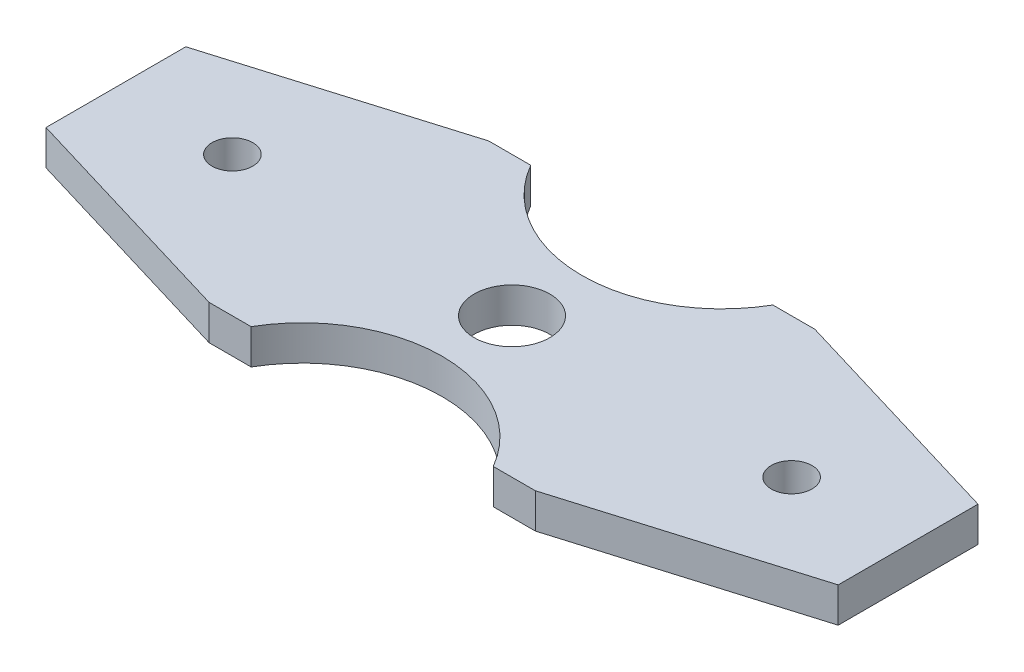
SolidWorks part; units mm, degrees
ref_plane "Front" through (0, 0, 0) normal (0, 0, 1) x (1, 0, 0)
ref_plane "Top" through (0, 0, 0) normal (0, 1, 0) x (1, 0, 0)
ref_plane "Right" through (0, 0, 0) normal (1, 0, 0) x (0, 0, -1)
sketch "Sketch1" plane through (0, 0, 0) normal (0, 1, 0) x (1, 0, 0)
  line L0 (44.3923, 24) -> (48, 24)
  line L1 (20, 0) -> (23.6077, 0)
  line L2 (0, 6) -> (0, 18)
  line L3 (20, 24) -> (23.6077, 24)
  line L4 (68, 6) -> (68, 18)
  line L5 (44.3923, 0) -> (48, 0)
  line L15 (0, 18) -> (20, 24)
  line L16 (68, 18) -> (48, 24)
  line L17 (68, 6) -> (48, 0)
  line L18 (0, 6) -> (20, 0)
  circle A0 centre (34, 12) radius 3.25
  circle A1 centre (10, 12) radius 1.75
  circle A2 centre (58, 12) radius 1.75
  arc A3 (23.6077, 24) -> (44.3923, 24) centre (34, 30) ccw
  arc A4 (44.3923, 0) -> (23.6077, 0) centre (34, -6) ccw
extrude "Extrude1" add sketch "Sketch1" along normal blind 3
